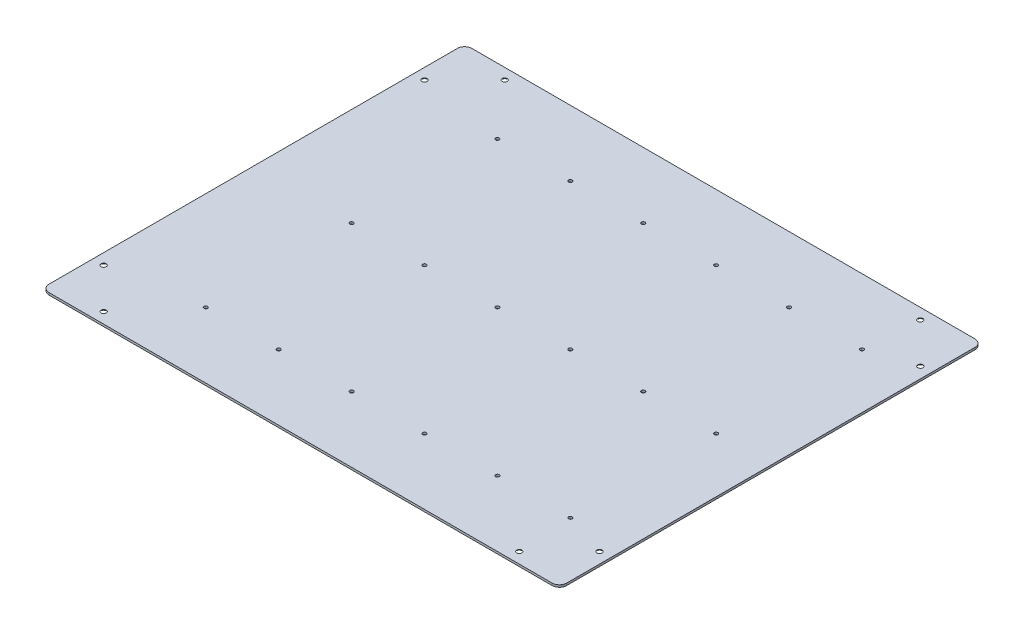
SolidWorks part; units mm, degrees
ref_plane "前视基准面" through (0, 0, 0) normal (0, 0, 1) x (1, 0, 0)
ref_plane "上视基准面" through (0, 0, 0) normal (0, 1, 0) x (1, 0, 0)
ref_plane "右视基准面" through (0, 0, 0) normal (1, 0, 0) x (0, 0, -1)
other "Configuration Table"
sketch "草图1" plane through (0, 0, 0) normal (0, 1, 0) x (1, 0, 0)
  line L1 (-355, 290) -> (355, 290)
  line L2 (-355, 290) -> (-355, -290)
  line L3 (-355, -290) -> (355, -290)
  line L4 (355, 290) -> (355, -290)
  line L5 (-355, 290) -> (355, -290) construction
  line L6 (-355, -290) -> (355, 290) construction
  point P0 (0, 0)
  point P6 (-285, -275)
  point P7 (285, 275)
  point P8 (285, -275)
  point P9 (-340, 220)
  point P10 (-340, -220)
  point P11 (340, -220)
  point P12 (-285, 275)
  point P13 (340, 220)
  point P14 (-220, -200)
  dimension "D15" = 70
  dimension "D1" = 15
  dimension "D2" = 70
  dimension "D3" = 70
  dimension "D4" = 15
  dimension "D5" = 70
  dimension "D6" = 15
  dimension "D7" = 70
  dimension "D8" = 15
  dimension "D9" = 15
  dimension "D10" = 70
  dimension "D11" = 15
  dimension "D12" = 15
  dimension "D13" = 90
  dimension "D14" = 135
  dimension "D16" = 70
  dimension "D17" = 70
  dimension "D18" = 15
extrude "凸台-拉伸1" add sketch "草图1" along normal blind 3
hole_wizard "M6 内六角花形半沉头螺钉的锥形沉头孔1" positions "草图4" profile "草图5" countersink size "M6" standard "GB"
sketch "草图4" plane through (0, 0, 0) normal (0, -1, 0) x (-1, 0, 0)
  point P0 (-285, 275)
  point P3 (-340, 220)
  point P6 (-340, -220)
  point P9 (-285, -275)
  point P12 (285, -275)
  point P15 (340, -220)
  point P18 (340, 220)
  point P21 (285, 275)
sketch "草图5" plane through (285, 0, -275) normal (1, 0, 0) x (0, 0, -1)
  line L0 (0, 0) -> (0, 3)
  line L1 (0, 3) -> (3.5, 3)
  line L2 (3.5, 3) -> (3.5, 2.9)
  line L3 (3.5, 2.9) -> (6.4, 0)
  line L5 (6.4, 0) -> (0, 0)
  line L6 (-3.5, 2.9) -> (-6.4, 0) construction
  line L11 (0, -6.35) -> (0, 107.95) construction
  dimension "通孔孔直径" = 7
  dimension "通孔孔深度" = 3
  dimension "近端锥形沉头孔直径" = 12.8
  dimension "近端锥形沉头孔角度" = 90
hole_wizard "M6 螺纹孔1" positions "草图6" profile "草图7" tap size "M6" standard "GB"
sketch "草图6" plane through (0, 3, 0) normal (0, 1, 0) x (1, 0, 0)
  point P0 (-220, -200)
sketch "草图7" plane through (-220, 3, 200) normal (1, 0, 0) x (0, 0, 1)
  line L0 (0, 0) -> (0, 3)
  line L1 (0, 3) -> (2.5, 3)
  line L2 (2.5, 3) -> (2.5, 0)
  line L5 (2.5, 0) -> (0, 0)
  line L11 (0, -6.35) -> (0, 107.95) construction
  dimension "通孔螺纹孔钻头直径" = 5
  dimension "通孔螺纹孔钻头深度" = 3
pattern_linear "阵列(线性)1" count 3 spacing 200 along (0, 0, -1) count 6 spacing 100 along (1, 0, 0) of "M6 螺纹孔1"
fillet "圆角1" radius 10 4 edges at (-355, 1.5, -290) (355, 1.5, -290) (-355, 1.5, 290) (355, 1.5, 290)
